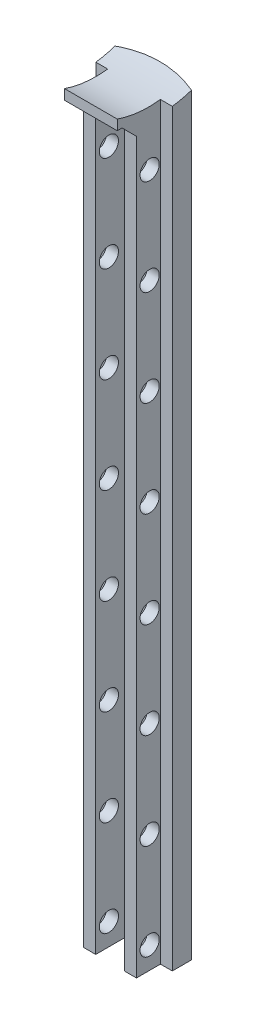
SolidWorks part; units mm, degrees
ref_plane "前视基准面" through (0, 0, 0) normal (0, 0, 1) x (1, 0, 0)
ref_plane "上视基准面" through (0, 0, 0) normal (0, 1, 0) x (1, 0, 0)
ref_plane "右视基准面" through (0, 0, 0) normal (1, 0, 0) x (0, 0, -1)
sketch "草图1" plane through (0, 0, 0) normal (0, 1, 0) x (1, 0, 0)
  line L1 (-17.8065, 39.4988) -> (-17.8065, 35.4988)
  line L2 (-17.8065, 35.4988) -> (-20.2817, 35.4988)
  line L3 (-20.2817, 35.4988) -> (-20.2817, 30.4988)
  line L4 (-33.7568, 39.4988) -> (-33.7568, 35.4988)
  line L5 (-33.7568, 35.4988) -> (-31.2817, 35.4988)
  line L6 (-31.2817, 35.4988) -> (-31.2817, 30.4988)
  line L7 (-28.7817, 36.9988) -> (-28.7817, 30.4988)
  line L8 (-31.2817, 30.4988) -> (-28.7817, 30.4988)
  line L9 (-22.7817, 30.4988) -> (-20.2817, 30.4988)
  line L10 (-28.7817, 36.9988) -> (-22.7817, 36.9988)
  line L13 (-22.7817, 36.9988) -> (-22.7817, 30.4988)
  line L14 (-28.7817, 36.9988) -> (-22.7817, 36.9988) construction
  line L15 (-22.7817, 36.9988) -> (-22.7817, 36.9988) construction
  line L16 (-28.7817, 36.9988) -> (-28.7817, 36.9988) construction
  line L17 (-22.7817, 36.9988) -> (-22.7817, 36.9988) construction
  line L18 (-28.7817, 36.9988) -> (-28.7817, 36.9988) construction
  line L19 (-33.7568, 39.4988) -> (-17.8065, 39.4988) construction
  arc A0 (-33.7568, 39.4988) -> (-17.8065, 39.4988) centre (-25.7817, 16.8626) cw
  dimension "D3" = 24
  dimension "D1" = 2.5
extrude "凸台-拉伸1" add sketch "草图1" along normal blind 150
sketch "草图2" plane through (-31.2817, 0, 0) normal (-1, 0, 0) x (0, 0, 1)
  circle A0 centre (-33.2488, 4.5989) radius 2
extrude "切除-拉伸1" cut sketch "草图2" against normal blind 21
sketch "草图4" plane through (0, 150, 0) normal (0, 1, 0) x (1, 0, 0)
  line L22 (-33.7568, 39.4988) -> (-33.7568, 35.4988)
  line L23 (-33.7568, 35.4988) -> (-31.2817, 35.4988)
  line L24 (-31.2817, 35.4988) -> (-31.2817, 30.4988)
  line L25 (-31.2817, 30.4988) -> (-28.7817, 30.4988)
  line L26 (-28.7817, 30.4988) -> (-28.7817, 36.9988)
  line L27 (-28.7817, 36.9988) -> (-22.7817, 36.9988)
  line L28 (-22.7817, 36.9988) -> (-22.7817, 30.4988)
  line L29 (-22.7817, 30.4988) -> (-20.2817, 30.4988)
  line L30 (-20.2817, 30.4988) -> (-20.2817, 35.4988)
  line L31 (-20.2817, 35.4988) -> (-17.8065, 35.4988)
  line L32 (-17.8065, 35.4988) -> (-17.8065, 39.4988)
  line L33 (-33.7568, 39.4988) -> (-33.7568, 35.4988)
  line L34 (-33.7568, 35.4988) -> (-31.2817, 35.4988)
  line L35 (-31.2817, 35.4988) -> (-31.2817, 30.4988)
  line L36 (-31.2817, 30.4988) -> (-28.7817, 30.4988)
  line L37 (-28.7817, 30.4988) -> (-28.7817, 36.9988)
  line L38 (-28.7817, 36.9988) -> (-22.7817, 36.9988)
  line L39 (-22.7817, 36.9988) -> (-22.7817, 30.4988)
  line L40 (-22.7817, 30.4988) -> (-20.2817, 30.4988)
  line L41 (-20.2817, 30.4988) -> (-20.2817, 35.4988)
  line L42 (-20.2817, 35.4988) -> (-17.8065, 35.4988)
  line L43 (-17.8065, 35.4988) -> (-17.8065, 39.4988)
  arc A2 (-17.8065, 39.4988) -> (-33.7568, 39.4988) centre (-25.7817, 16.8626) ccw
  arc A3 (-17.8065, 39.4988) -> (-33.7568, 39.4988) centre (-25.7817, 16.8626) ccw
  dimension "D1" = 0
extrude "凸台-拉伸2" add sketch "草图4" along normal blind 5
pattern_linear "阵列(线性)1" count 8 spacing 20 along (0, 1, 0) of "切除-拉伸1"
ref_plane "基准面1" through (-25.7817, 0, 0) normal (-1, 0, 0) x (0, 0, 1)
sketch "草图7" plane through (0, 155, 0) normal (0, 1, 0) x (1, 0, 0)
  line L12 (-31.2817, 30.4988) -> (-31.2817, 26.4988)
  line L13 (-31.2817, 26.4988) -> (-20.2817, 26.4988)
  line L14 (-20.2817, 26.4988) -> (-20.2817, 30.4988)
  line L22 (-33.7568, 39.4988) -> (-33.7568, 35.4988)
  line L23 (-33.7568, 35.4988) -> (-31.2817, 35.4988)
  line L24 (-31.2817, 35.4988) -> (-31.2817, 30.4988)
  line L25 (-31.2817, 30.4988) -> (-28.7817, 30.4988)
  line L26 (-28.7817, 30.4988) -> (-28.7817, 36.9988)
  line L27 (-28.7817, 36.9988) -> (-22.7817, 36.9988)
  line L28 (-22.7817, 36.9988) -> (-22.7817, 30.4988)
  line L29 (-22.7817, 30.4988) -> (-20.2817, 30.4988)
  line L30 (-20.2817, 30.4988) -> (-20.2817, 35.4988)
  line L31 (-20.2817, 35.4988) -> (-17.8065, 35.4988)
  line L32 (-17.8065, 35.4988) -> (-17.8065, 39.4988)
  line L33 (-33.7568, 39.4988) -> (-33.7568, 35.4988)
  line L34 (-33.7568, 35.4988) -> (-31.2817, 35.4988)
  line L35 (-31.2817, 35.4988) -> (-31.2817, 30.4988)
  line L41 (-20.2817, 30.4988) -> (-20.2817, 35.4988)
  line L42 (-20.2817, 35.4988) -> (-17.8065, 35.4988)
  line L43 (-17.8065, 35.4988) -> (-17.8065, 39.4988)
  arc A2 (-17.8065, 39.4988) -> (-33.7568, 39.4988) centre (-25.7817, 16.8626) ccw
  arc A3 (-17.8065, 39.4988) -> (-33.7568, 39.4988) centre (-25.7817, 16.8626) ccw
  dimension "D1" = 0
extrude "凸台-拉伸3" add sketch "草图7" along normal blind 5
sketch "草图8" plane through (-25.7817, 0, 0) normal (-1, 0, 0) x (0, 0, 1)
  line L1 (-26.4988, 157.107) -> (-26.4988, 160)
  line L2 (-26.4988, 160) -> (-26.4988, 155) construction
  line L3 (-26.4988, 160) -> (-40.8626, 160)
  line L4 (-40.8626, 160) -> (-40.8626, 157.5846)
  arc A1 (-40.8626, 157.5846) -> (-26.4988, 157.107) centre (-33.0605, 176) ccw
extrude "切除-拉伸3" cut sketch "草图8" against normal blind 15 and the other way blind 18
chamfer "倒角1" distance 3 angle 45 2 edges at (-21.5317, 155, -30.4988) (-30.0317, 155, -30.4988)
chamfer "倒角2" distance 4 angle 60 1 edges at (-25.7817, 155, -36.9988)
